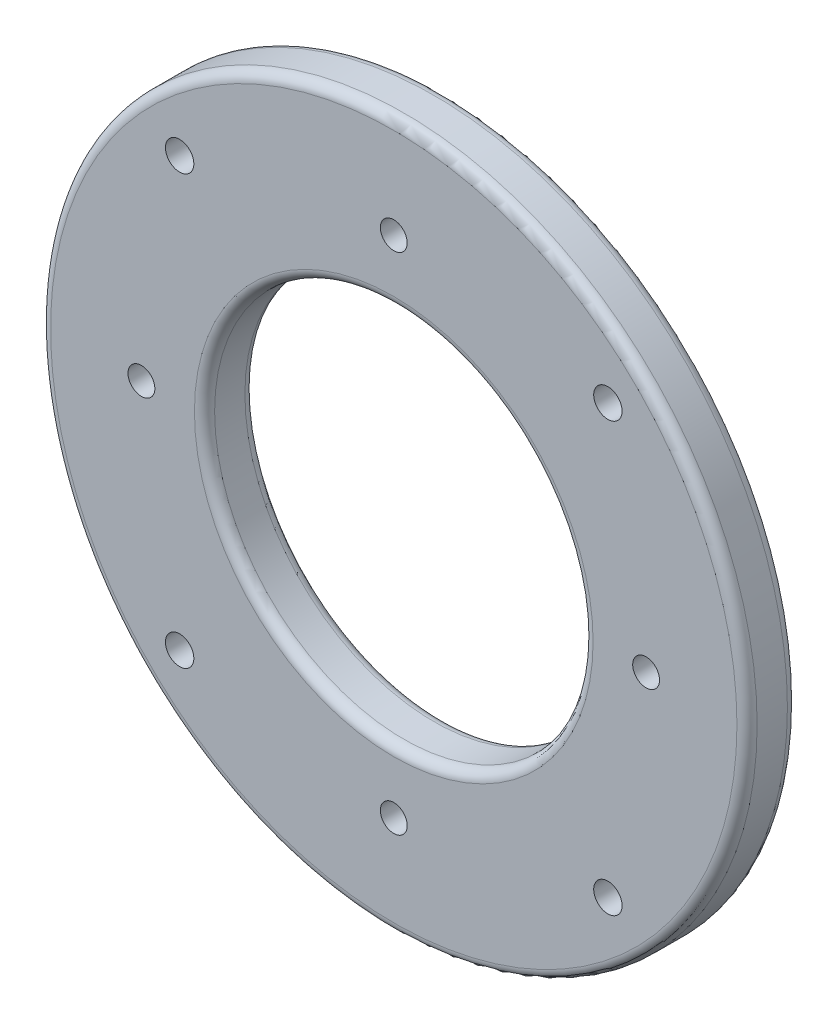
SolidWorks part; units mm, degrees
ref_plane "Front Plane" through (0, 0, 0) normal (0, 0, 1) x (1, 0, 0)
ref_plane "Top Plane" through (0, 0, 0) normal (0, 1, 0) x (1, 0, 0)
ref_plane "Right Plane" through (0, 0, 0) normal (1, 0, 0) x (0, 0, -1)
sketch "Sketch1" plane through (0, 0, 0) normal (0, 0, 1) x (1, 0, 0)
  circle A0 centre (0, 0) radius 88.9
  circle A1 centre (0, 0) radius 47.625
  dimension "D1" = 177.8
  dimension "D2" = 95.25
extrude "Boss-Extrude1" add sketch "Sketch1" along normal blind 12.7
hole_wizard "1/4 Clearance Hole2" positions "Sketch5" profile "Sketch6" hole size "1/4" standard "ANSI Inch"
sketch "Sketch5" plane through (0, 0, 12.7) normal (0, 0, 1) x (1, 0, 0)
  line L0 (-63.5, 0) -> (0, 0)
  line L1 (0, 0) -> (63.5, 0)
  line L2 (0, 63.5) -> (0, -63.5)
  point P0 (-63.5, 0)
  point P2 (63.5, 0)
  point P9 (0, -63.5)
  point P11 (0, 63.5)
  point P18 (0, 0)
  dimension "D1" = 127
  dimension "D2" = 127
sketch "Sketch6" plane through (-63.5, 0, 12.7) normal (1, 0, 0) x (0, -1, 0)
  line L0 (0, 0) -> (0, 12.7)
  line L1 (0, 12.7) -> (3.3782, 12.7)
  line L2 (3.3782, 12.7) -> (3.3782, 0)
  line L5 (3.3782, 0) -> (0, 0)
  line L11 (0, -6.35) -> (0, 107.95) construction
  dimension "Thru Hole Dia." = 6.7564
  dimension "Thru Hole Depth" = 12.7
hole_wizard "1/4 Clearance Hole1" positions "Sketch10" profile "Sketch11" hole size "1/4" standard "ANSI Inch"
sketch "Sketch10" plane through (0, 0, 12.7) normal (0, 0, 1) x (1, 0, 0)
  line L2 (-53.8815, 53.8815) -> (0, 0)
  line L4 (0, 0) -> (-88.9, 0)
  line L6 (0, 0) -> (0, 88.9)
  line L8 (-88.9, 0) -> (0, 88.9)
  circle A1 centre (0, 0) radius 88.9 construction
  point P13 (-53.8815, 53.8815)
  point P50 (-44.45, 44.45)
  dimension "D1" = 76.2
sketch "Sketch11" plane through (-53.8815, 53.8815, 12.7) normal (1, 0, 0) x (0, -1, 0)
  line L0 (0, 0) -> (0, 12.7)
  line L1 (0, 12.7) -> (3.5712, 12.7)
  line L2 (3.5712, 12.7) -> (3.5712, 0)
  line L5 (3.5712, 0) -> (0, 0)
  line L11 (0, -6.35) -> (0, 107.95) construction
  dimension "Thru Hole Dia." = 7.1425
  dimension "Thru Hole Depth" = 12.7
pattern_circular "CirPattern1" count 4 over 360 of "1/4 Clearance Hole1"
fillet "Fillet1" radius 2.54
